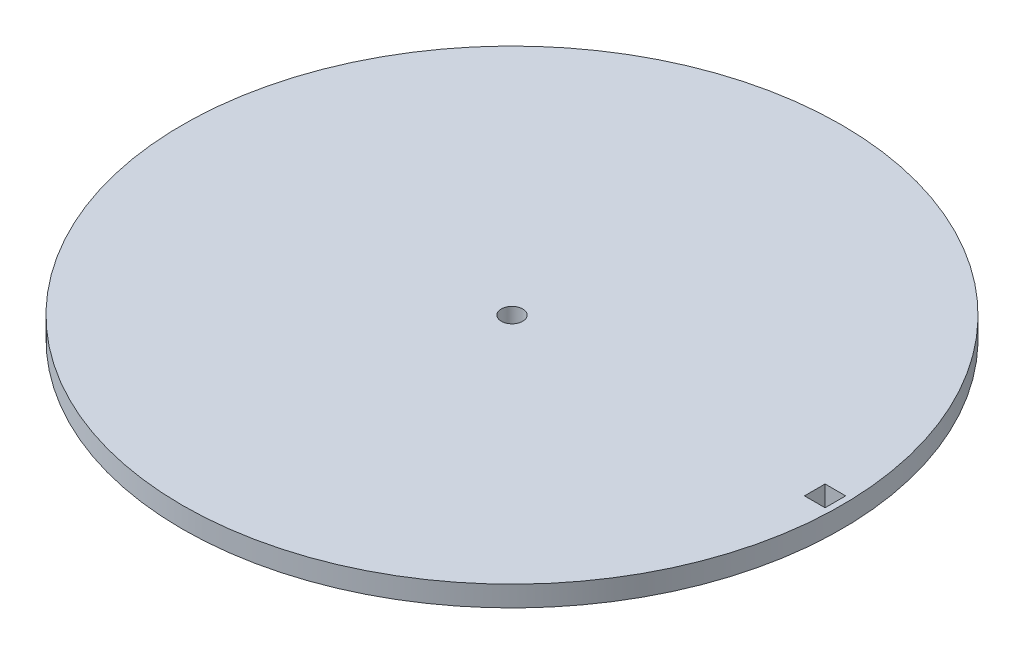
SolidWorks part; units mm, degrees
ref_plane "Front Plane" through (0, 0, 0) normal (0, 0, 1) x (1, 0, 0)
ref_plane "Top Plane" through (0, 0, 0) normal (0, 1, 0) x (1, 0, 0)
ref_plane "Right Plane" through (0, 0, 0) normal (1, 0, 0) x (0, 0, -1)
sketch "Sketch1" plane through (0, 0, 0) normal (0, 1, 0) x (1, 0, 0)
  circle A0 centre (0, 0) radius 50.8
extrude "Boss-Extrude1" add sketch "Sketch1" along normal blind 3.175
sketch "Sketch2" plane through (0, 0, 0) normal (0, -1, 0) x (1, 0, 0)
  circle A0 centre (0, 0) radius 1.651
extrude "Cut-Extrude1" cut sketch "Sketch2" against normal blind 3.175
sketch "Sketch5" plane through (0, 3.175, 0) normal (0, 1, 0) x (1, 0, 0)
  line L2 (49.8475, -1.5875) -> (46.6725, -1.5875)
  line L3 (49.8475, -1.5875) -> (49.8475, 1.5875)
  line L4 (49.8475, 1.5875) -> (46.6725, 1.5875)
  line L5 (46.6725, -1.5875) -> (46.6725, 1.5875)
extrude "Cut-Extrude4" cut sketch "Sketch5" against normal blind 3.175
